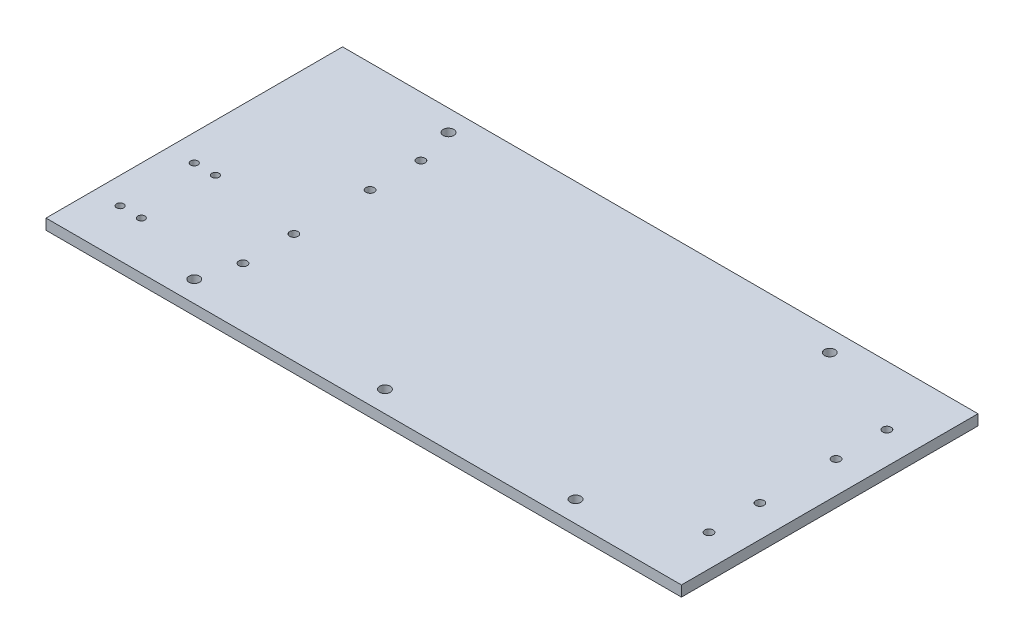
SolidWorks part; units mm, degrees
ref_plane "Front Plane" through (0, 0, 0) normal (0, 0, 1) x (1, 0, 0)
ref_plane "Top Plane" through (0, 0, 0) normal (0, 1, 0) x (1, 0, 0)
ref_plane "Right Plane" through (0, 0, 0) normal (1, 0, 0) x (0, 0, -1)
sketch "Sketch1" plane through (0, 0, 0) normal (0, 1, 0) x (1, 0, 0)
  line L1 (-190.5, -88.9) -> (190.5, -88.9)
  line L2 (-190.5, -88.9) -> (-190.5, 88.9)
  line L3 (-190.5, 88.9) -> (190.5, 88.9)
  line L4 (190.5, -88.9) -> (190.5, 88.9)
  point P4 (0, 88.9)
  point P6 (-190.5, 0)
  dimension "D1" = 381
  dimension "D2" = 177.8
extrude "Plate" add sketch "Sketch1" along normal blind 6.35
sketch "Sketch2" plane through (0, 0, 88.9) normal (0, 0, 1) x (1, 0, 0)
  line L1 (-190.5, 0) -> (190.5, 0)
  line L2 (-190.5, 0) -> (-190.5, 31.75)
  line L3 (-190.5, 31.75) -> (190.5, 31.75)
  line L4 (190.5, 0) -> (190.5, 31.75)
  dimension "D1" = 31.75
extrude "Boss-Extrude2" [suppressed] add sketch "Sketch2" along normal blind 6.35
sketch "Sketch3" [suppressed] plane through (0, 0, 95.25) normal (0, 0, 1) x (1, 0, 0)
  line L0 (0, 0) -> (0, 31.75) construction
  line L1 (-190.5, 0) -> (190.5, 0) construction
  line L2 (190.5, 31.75) -> (-190.5, 31.75) construction
  circle A0 centre (0, 19.05) radius 3.175
  circle A1 centre (-127, 19.05) radius 3.175
  circle A2 centre (127, 19.05) radius 3.175
  dimension "D1" = 6.35
  dimension "D2" = 12.7
  dimension "D3" = 127
  dimension "D4" = 127
extrude "Cut-Extrude1" [suppressed] cut sketch "Sketch3" against normal up to surface (6.35 mm away)
sketch "Sketch4" plane through (0, 0, 0) normal (0, -1, 0) x (1, 0, 0)
  line L2 (190.5, -88.9) -> (-190.5, -88.9) construction
  circle A0 centre (0, 76.2) radius 3.175
  circle A1 centre (-114.3, 76.2) radius 3.175
  circle A2 centre (114.3, 76.2) radius 3.175
  circle A3 centre (-114.3, -76.2) radius 3.175
  circle A5 centre (114.3, -76.2) radius 3.175
  dimension "D2" = 6.35
  dimension "D3" = 114.3
  dimension "D5" = 12.7
  dimension "D1" = 76.2
  dimension "D4" = 114.3
extrude "ChassisMountingHoles" cut sketch "Sketch4" against normal up to surface (6.35 mm away)
sketch "Sketch5" plane through (0, 0, 0) normal (0, -1, 0) x (1, 0, 0)
  line L0 (190.5, 88.9) -> (190.5, -88.9) construction
  line L3 (0, 0) -> (0, 229.4543) construction
  line L4 (171.45, 22.86) -> (171.45, 53.34) construction
  line L5 (0, 0) -> (353.5615, 0) construction
  circle A2 centre (171.45, 53.34) radius 2.5019
  circle A8 centre (171.45, 22.86) radius 2.5019
  circle A14 centre (-107.95, 53.34) radius 2.5019
  circle A15 centre (-107.95, 22.86) radius 2.5019
  circle A16 centre (171.45, -53.34) radius 2.5019
  circle A17 centre (171.45, -22.86) radius 2.5019
  circle A18 centre (-107.95, -22.86) radius 2.5019
  circle A19 centre (-107.95, -53.34) radius 2.5019
  point P6 (171.45, 38.1)
  dimension "D1" = 5.0038
  dimension "D2" = 19.05
  dimension "D3" = 38.1
  dimension "D5" = 30.48
  dimension "D6" = 279.4
extrude "LeadScrewGuideMounts" cut sketch "Sketch5" against normal up to surface (6.35 mm away)
sketch "Sketch6" plane through (0, 0, 0) normal (0, -1, 0) x (1, 0, 0)
  line L0 (-190.5, -88.9) -> (-190.5, 88.9) construction
  line L1 (-190.5, 88.9) -> (190.5, 88.9) construction
  circle A0 centre (-174.625, 60.325) radius 2.1527
  circle A1 centre (-161.925, 60.325) radius 2.1527
  circle A2 centre (-174.625, 15.875) radius 2.1527
  circle A3 centre (-161.925, 15.875) radius 2.1527
  point P10 (0, 0)
  dimension "D3" = 4.3053
  dimension "D1" = 12.7
  dimension "D2" = 15.875
  dimension "D4" = 44.45
  dimension "D5" = 28.575
extrude "LeadScrewMotorMount" cut sketch "Sketch6" against normal up to surface (6.35 mm away)
